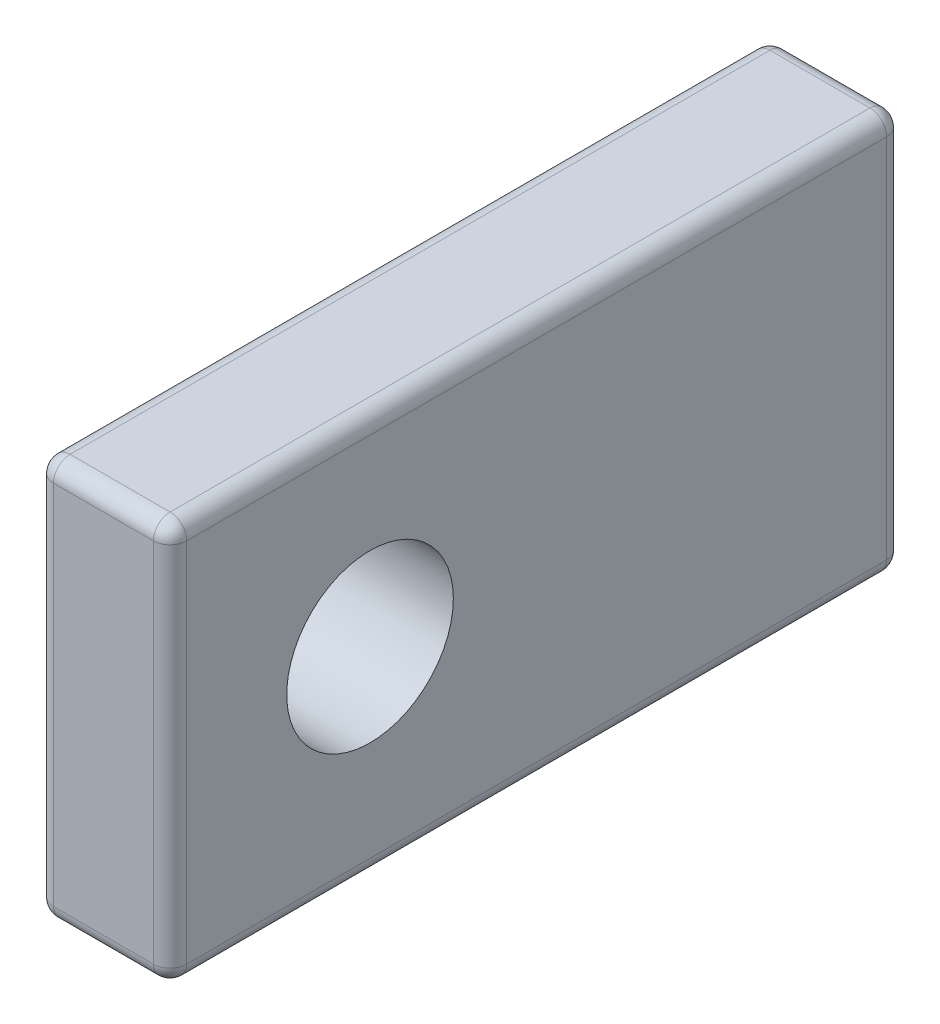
SolidWorks part; units mm, degrees
ref_plane "Front Plane" through (0, 0, 0) normal (0, 0, 1) x (1, 0, 0)
ref_plane "Top Plane" through (0, 0, 0) normal (0, 1, 0) x (1, 0, 0)
ref_plane "Right Plane" through (0, 0, 0) normal (1, 0, 0) x (0, 0, -1)
sketch "Sketch2" plane through (0, 0, 0) normal (1, 0, 0) x (0, 0, -1)
  line L1 (-9.525, 9.525) -> (25.4, 9.525)
  line L2 (-9.525, 9.525) -> (-9.525, -9.525)
  line L3 (-9.525, -9.525) -> (25.4, -9.525)
  line L4 (25.4, 9.525) -> (25.4, -9.525)
  circle A0 centre (0, 0) radius 3.9688
  dimension "D1" = 7.9375
  dimension "D2" = 9.525
  dimension "D3" = 34.925
  dimension "D4" = 19.05
  dimension "D5" = 9.525
extrude "Boss-Extrude1" add sketch "Sketch2" along normal mid plane 6.35
fillet "Fillet1" radius 0.7937 12 edges at (-3.175, -9.525, -7.9375) (0, -9.525, -25.4) (0, 9.525, -25.4) (-3.175, 9.525, -7.9375) (-3.175, 0, -25.4) (3.175, 0, -25.4) (3.175, -9.525, -7.9375) (0, -9.525, 9.525) (-3.175, 0, 9.525) (3.175, 0, 9.525) (0, 9.525, 9.525) (3.175, 9.525, -7.9375)
